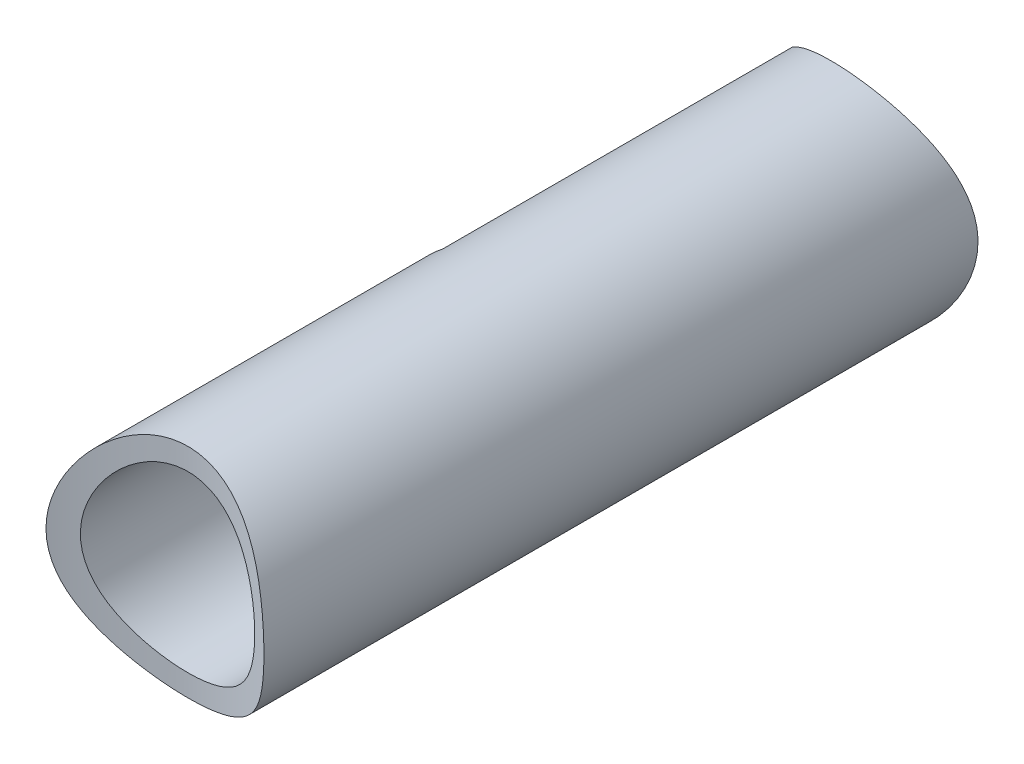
SolidWorks part; units mm, degrees
ref_plane "Front Plane" through (0, 0, 0) normal (0, 0, 1) x (1, 0, 0)
ref_plane "Top Plane" through (0, 0, 0) normal (0, 1, 0) x (1, 0, 0)
ref_plane "Right Plane" through (0, 0, 0) normal (1, 0, 0) x (0, 0, -1)
sketch "Sketch1" plane through (0, 0, 0) normal (0, 0, 1) x (1, 0, 0)
  circle A0 centre (0, 0) radius 15.875
  circle A1 centre (0, 0) radius 12.7
  dimension "D1" = 31.75
  dimension "D2" = 3.175
extrude "Boss-Extrude1" add sketch "Sketch1" against normal blind 152.5524
sketch "Sketch2" plane through (0, 0, 0) normal (1, 0, 0) x (0, 0, -1)
  line L0 (0, 15.875) -> (0, -15.875) construction
  line L1 (152.5524, 15.875) -> (0, 15.875) construction
  circle A0 centre (152.4, 3.175) radius 77.7875
  dimension "D1" = 155.575
  dimension "D2" = 152.4
  dimension "D3" = 12.7
extrude "Cut-Extrude1" cut sketch "Sketch2" against normal blind 203.2 from offset 9.525
sketch "Sketch3" plane through (0, 0, 0) normal (0, 1, 0) x (1, 0, 0)
  line L0 (12.7, 152.5524) -> (-9.525, 152.5524) construction
  circle A0 centre (1.5875, 152.5524) radius 28.575
  circle A1 centre (0, 0) radius 28.575
  dimension "D1" = 57.15
  dimension "D2" = 57.15
extrude "Cut-Extrude2" cut sketch "Sketch3" against normal through all both and the other way through all
